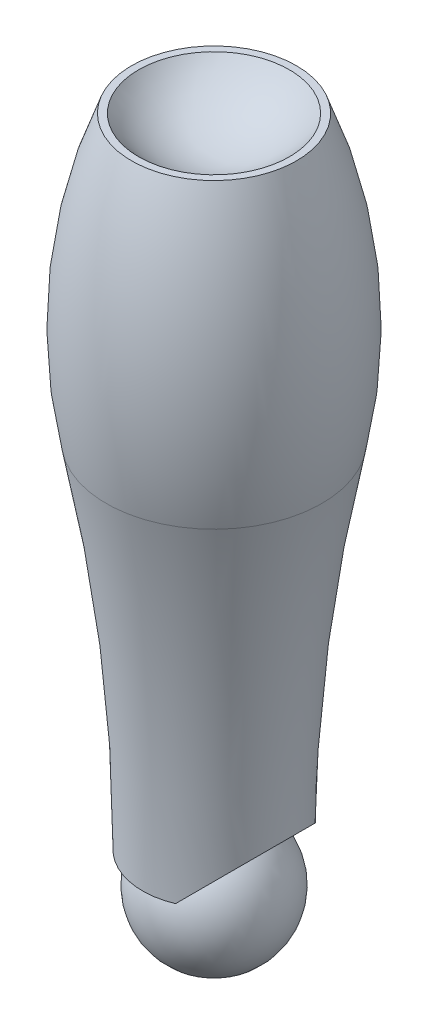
SolidWorks part; units mm, degrees
ref_plane "Přední" through (0, 0, 0) normal (0, 0, 1) x (1, 0, 0)
ref_plane "Horní" through (0, 0, 0) normal (0, 1, 0) x (1, 0, 0)
ref_plane "Pravá" through (0, 0, 0) normal (1, 0, 0) x (0, 0, -1)
sketch "Skica1" plane through (0, 0, 0) normal (0, 0, 1) x (1, 0, 0)
  line L0 (0, 0) -> (0, 333.5)
  line L1 (0, 333.5) -> (43.125, 333.5)
  line L2 (37.375, 0) -> (0, 0)
  line L3 (0, 0) -> (0, -16.447) construction
  line L4 (37.375, 0) -> (37.375, -72.7987) construction
  arc A0 (43.125, 333.5) -> (56.4242, 185) centre (-194.9879, 237.3299) cw
  arc A1 (56.4242, 185) -> (37.375, 0) centre (945.2326, 0) ccw
  dimension "D4" = 123.625
  dimension "D1" = 86.25
  dimension "D2" = 333.5
  dimension "D3" = 74.75
  dimension "D5" = 185
revolve "Otočit kolem osy1" add sketch "Skica1" angle 360 about L0
sketch "Skica2" plane through (0, 0, 0) normal (0, 0, 1) x (1, 0, 0)
  line L0 (0, 313.5) -> (0, 362.38)
  line L1 (0, 362.38) -> (-48.88, 362.38)
  line L2 (0, 313.5) -> (58.1664, 313.5) construction
  line L3 (0, 362.38) -> (0, 288.1436) construction
  line L4 (-48.88, 362.38) -> (-48.88, 284.0477) construction
  line L5 (43.125, 333.5) -> (-43.125, 333.5) construction
  arc A0 (0, 313.5) -> (-48.88, 362.38) centre (0, 362.38) cw
  dimension "D1" = 97.76
  dimension "D2" = 20
revolve "Odebrat otočením1" cut sketch "Skica2" angle 360 about L0
sketch "Skica3" plane through (0, 0, 0) normal (0, 0, 1) x (1, 0, 0)
  line L0 (0, -16) -> (0, 18.5)
  line L1 (-34.5, -16) -> (0, -16) construction
  line L3 (0, -16) -> (0, -50.5)
  line L4 (-37.375, 0) -> (37.375, 0) construction
  arc A0 (0, 18.5) -> (0, -50.5) centre (0, -16) ccw
  dimension "D3" = 34.5
  dimension "D1" = 34.5
  dimension "D2" = 16
sketch "Skica4" plane through (0, 0, 0) normal (0, 0, 1) x (1, 0, 0)
  line L0 (14.375, 0) -> (37.674, 23.299)
  line L1 (-37.375, 0) -> (37.375, 0) construction
  arc A0 (56.4242, 185) -> (37.375, 0) centre (945.2326, 0) ccw construction
  dimension "D1" = 45
  dimension "D2" = 14.375
sketch "Skica5" plane through (0, 0, 0) normal (0, -1, 0) x (1, 0, 0)
  line L0 (14.375, 0) -> (14.375, 34.5)
  circle A0 centre (0, 0) radius 37.375 construction
ref_plane "Rovina1" through (7.1875, -7.1875, 0) normal (0.7071, -0.7071, 0) x (0, 0, -1)
other "Odebrat povrchem1"
revolve "Otočit kolem osy2" add sketch "Skica3" angle 360 about L0
